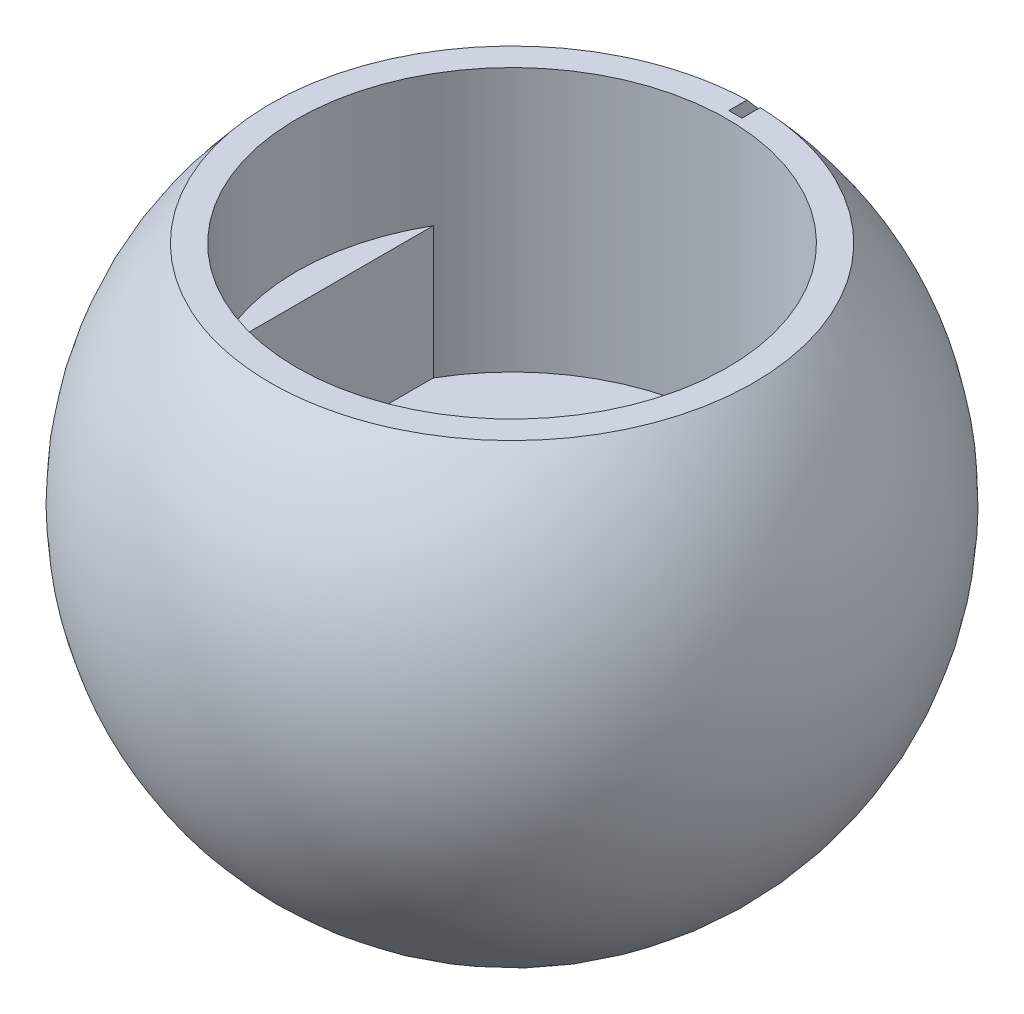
SolidWorks part; units mm, degrees
ref_plane "Front Plane" through (0, 0, 0) normal (0, 0, 1) x (1, 0, 0)
ref_plane "Top Plane" through (0, 0, 0) normal (0, 1, 0) x (1, 0, 0)
ref_plane "Right Plane" through (0, 0, 0) normal (1, 0, 0) x (0, 0, -1)
sketch "Sketch1" plane through (0, 0, 0) normal (1, 0, 0) x (0, 0, -1)
  line L0 (-25, 0) -> (25, 0)
  arc A0 (25, 0) -> (-25, 0) centre (0, 0) cw
  dimension "D1" = 50
revolve "Revolve1" add sketch "Sketch1" angle 360 about L0
ref_plane "Plane1" through (0, 17, 0) normal (0, 1, 0) x (-1, 0, 0)
ref_plane "Plane2" through (0, -23, 0) normal (0, 1, 0) x (-1, 0, 0)
other "SurfaceCut1"
other "SurfaceCut2"
sketch "Sketch2" plane through (0, 17, 0) normal (0, 1, 0) x (-1, 0, 0)
  circle A2 centre (0, 0) radius 16.3303
  circle A3 centre (0, 0) radius 16.3303
  dimension "D1" = 2
extrude "Cut-Extrude1" cut sketch "Sketch2" against normal blind 10
sketch "Sketch3" plane through (0, 7, 0) normal (0, 1, 0) x (-1, 0, 0)
  line L0 (-7.0712, -12.2477) -> (0, -16.3303)
  line L2 (14.1425, -8.1652) -> (14.1425, 8.1652)
  line L3 (14.1425, 8.1652) -> (0, 16.3303)
  line L4 (0, 16.3303) -> (-14.1425, 8.1652)
  line L5 (-14.1425, 8.1652) -> (-14.1425, -8.1652)
  line L6 (7.0712, -12.2477) -> (14.1425, -8.1652)
  circle A0 centre (0, 0) radius 14.1425 construction
  circle A1 centre (0, 0) radius 16.3303 construction
  arc A2 (-14.1425, -8.1652) -> (14.1425, -8.1652) centre (0, 0) ccw
  point P1 (0, 0)
extrude "Cut-Extrude2" cut sketch "Sketch3" against normal blind 10
sketch "Sketch4" plane through (0, -23, 0) normal (0, -1, 0) x (1, 0, 0)
  circle A1 centre (0, 0) radius 9.798
  circle A2 centre (0, 0) radius 9.798
  dimension "D1" = 0
extrude "Cut-Extrude3" cut sketch "Sketch4" against normal through all
sketch "Sketch5" plane through (0, 0, 0) normal (0, 1, 0) x (1, 0, 0)
  line L0 (0, 0) -> (0, 25) construction
  line L1 (-0.5, 24.995) -> (-0.5, 23.9948)
  line L2 (0.5, 24.995) -> (0.5, 23.9948)
  line L3 (0, 0) -> (27.0264, 0) construction
  circle A0 centre (0, 0) radius 25 construction
  arc A1 (0.5, 24.995) -> (-0.5, 24.995) centre (0, 0) ccw
  arc A2 (0.5, 23.9948) -> (-0.5, 23.9948) centre (0, 0) ccw
  dimension "D2" = 1
  dimension "D1" = 1
revolve "Cut-Revolve1" cut sketch "Sketch5" angle 180 about L3
